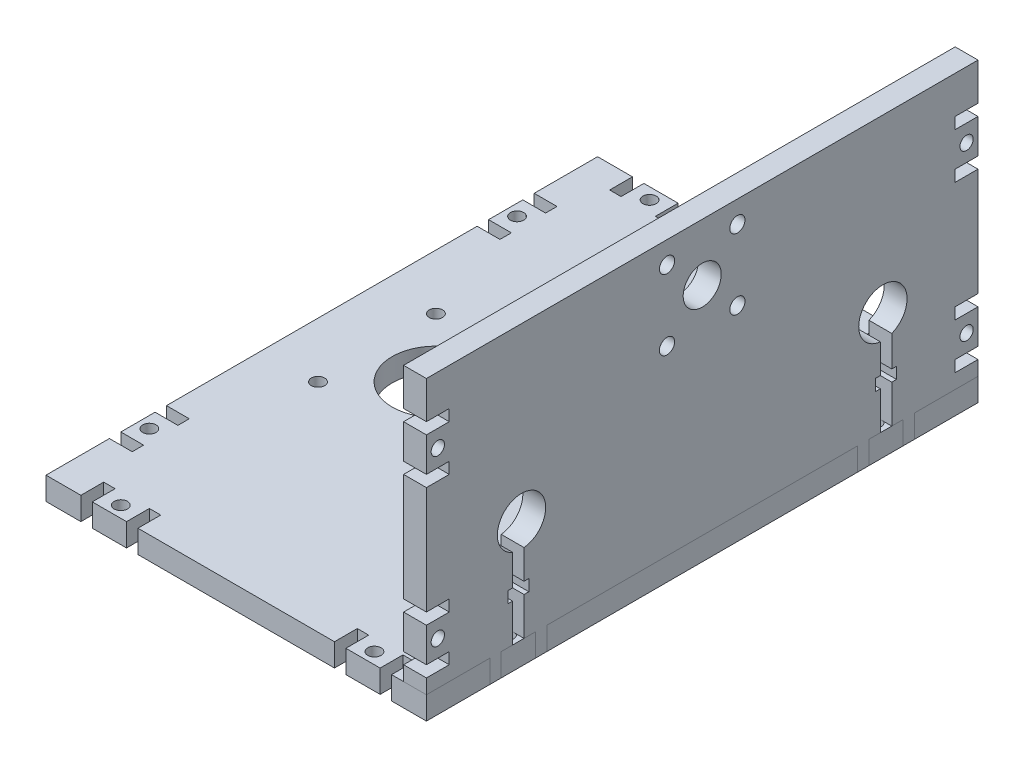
SolidWorks part; units mm, degrees
ref_plane "Front Plane" through (0, 0, 0) normal (0, 0, 1) x (1, 0, 0)
ref_plane "Top Plane" through (0, 0, 0) normal (0, 1, 0) x (1, 0, 0)
ref_plane "Right Plane" through (0, 0, 0) normal (1, 0, 0) x (0, 0, -1)
sketch "Sketch1" plane through (0, 0, 0) normal (0, 1, 0) x (1, 0, 0)
  line L1 (-50, -72.5) -> (50, -72.5)
  line L2 (-50, -72.5) -> (-50, 72.5)
  line L3 (-50, 72.5) -> (50, 72.5)
  line L4 (50, -72.5) -> (50, 72.5)
  line L5 (-50, -72.5) -> (50, 72.5) construction
  line L6 (-50, 72.5) -> (50, -72.5) construction
  point P0 (0, 0)
  dimension "D1" = 100
  dimension "D2" = 145
extrude "Boss-Extrude1" add sketch "Sketch1" along normal blind 6
sketch "Sketch2" plane through (0, 6, 0) normal (0, 1, 0) x (1, 0, 0)
  line L0 (50, 69.5) -> (-50, 69.5) construction
  line L1 (-50, -69.5) -> (50, -69.5) construction
  line L2 (-47, 72.5) -> (-47, -72.5) construction
  line L3 (50, 66.5) -> (-50, 66.5) construction
  line L4 (47, -72.5) -> (47, 72.5) construction
  line L5 (-44, 72.5) -> (-44, -72.5) construction
  line L6 (44, -72.5) -> (44, 72.5) construction
  line L7 (-50, -66.5) -> (50, -66.5) construction
  line L12 (50, -72.5) -> (50, 72.5)
  line L13 (50, 72.5) -> (-50, 72.5)
  line L14 (-50, 72.5) -> (-50, -72.5)
  line L15 (-50, -72.5) -> (50, -72.5)
  line L16 (50, -72.5) -> (50, 72.5) construction
  line L17 (50, 72.5) -> (-50, 72.5) construction
  line L18 (-50, 72.5) -> (-50, -72.5) construction
  line L19 (-50, -72.5) -> (50, -72.5) construction
  line L21 (-50, 55.8333) -> (-44, 55.8333)
  line L22 (-50, 55.8333) -> (-50, 52.8333)
  line L23 (-50, 52.8333) -> (-44, 52.8333)
  line L24 (-44, 55.8333) -> (-44, 52.8333)
  line L25 (-33.3333, 69.5) -> (-33.3333, 66.5) construction
  line L26 (-40.8333, 66.5) -> (-37.8333, 66.5)
  line L27 (-40.8333, 66.5) -> (-40.8333, 72.5)
  line L28 (-40.8333, 72.5) -> (-37.8333, 72.5)
  line L29 (-37.8333, 66.5) -> (-37.8333, 72.5)
  line L30 (-47, 48.3333) -> (-44, 48.3333) construction
  line L31 (0, 72.5) -> (0, 0) construction
  line L32 (0, 0) -> (-50, 0) construction
  line L33 (-25.8333, 72.5) -> (-28.8333, 72.5)
  line L34 (-28.8333, 66.5) -> (-28.8333, 72.5)
  line L35 (-25.8333, 66.5) -> (-28.8333, 66.5)
  line L36 (-25.8333, 66.5) -> (-25.8333, 72.5)
  line L37 (-50, 43.8333) -> (-44, 43.8333)
  line L38 (-44, 40.8333) -> (-44, 43.8333)
  line L39 (-50, 40.8333) -> (-44, 40.8333)
  line L40 (-50, 40.8333) -> (-50, 43.8333)
  line L41 (50, 40.8333) -> (50, 43.8333)
  line L42 (50, 40.8333) -> (44, 40.8333)
  line L43 (44, 40.8333) -> (44, 43.8333)
  line L44 (50, 43.8333) -> (44, 43.8333)
  line L45 (50, 52.8333) -> (44, 52.8333)
  line L46 (44, 55.8333) -> (44, 52.8333)
  line L47 (50, 55.8333) -> (44, 55.8333)
  line L48 (50, 55.8333) -> (50, 52.8333)
  line L49 (40.8333, 72.5) -> (37.8333, 72.5)
  line L50 (37.8333, 66.5) -> (37.8333, 72.5)
  line L51 (40.8333, 66.5) -> (37.8333, 66.5)
  line L52 (40.8333, 66.5) -> (40.8333, 72.5)
  line L53 (25.8333, 66.5) -> (25.8333, 72.5)
  line L54 (25.8333, 66.5) -> (28.8333, 66.5)
  line L55 (28.8333, 66.5) -> (28.8333, 72.5)
  line L56 (25.8333, 72.5) -> (28.8333, 72.5)
  line L57 (50, -40.8333) -> (44, -40.8333)
  line L58 (44, -40.8333) -> (44, -43.8333)
  line L59 (50, -43.8333) -> (44, -43.8333)
  line L60 (50, -40.8333) -> (50, -43.8333)
  line L61 (50, -55.8333) -> (50, -52.8333)
  line L62 (50, -55.8333) -> (44, -55.8333)
  line L63 (44, -55.8333) -> (44, -52.8333)
  line L64 (50, -52.8333) -> (44, -52.8333)
  line L65 (40.8333, -66.5) -> (40.8333, -72.5)
  line L66 (40.8333, -66.5) -> (37.8333, -66.5)
  line L67 (37.8333, -66.5) -> (37.8333, -72.5)
  line L68 (40.8333, -72.5) -> (37.8333, -72.5)
  line L69 (25.8333, -66.5) -> (28.8333, -66.5)
  line L70 (28.8333, -66.5) -> (28.8333, -72.5)
  line L71 (25.8333, -72.5) -> (28.8333, -72.5)
  line L72 (25.8333, -66.5) -> (25.8333, -72.5)
  line L73 (-50, -40.8333) -> (-50, -43.8333)
  line L74 (-50, -40.8333) -> (-44, -40.8333)
  line L75 (-44, -40.8333) -> (-44, -43.8333)
  line L76 (-50, -43.8333) -> (-44, -43.8333)
  line L77 (-50, -52.8333) -> (-44, -52.8333)
  line L78 (-44, -55.8333) -> (-44, -52.8333)
  line L79 (-50, -55.8333) -> (-44, -55.8333)
  line L80 (-50, -55.8333) -> (-50, -52.8333)
  line L81 (-40.8333, -72.5) -> (-37.8333, -72.5)
  line L82 (-37.8333, -66.5) -> (-37.8333, -72.5)
  line L83 (-40.8333, -66.5) -> (-37.8333, -66.5)
  line L84 (-40.8333, -66.5) -> (-40.8333, -72.5)
  line L85 (-25.8333, -66.5) -> (-25.8333, -72.5)
  line L86 (-25.8333, -66.5) -> (-28.8333, -66.5)
  line L87 (-28.8333, -66.5) -> (-28.8333, -72.5)
  line L88 (-25.8333, -72.5) -> (-28.8333, -72.5)
  circle A0 centre (-33.3333, 69.5) radius 1.75
  circle A1 centre (-47, 48.3333) radius 1.75
  circle A2 centre (47, 48.3333) radius 1.75
  circle A3 centre (33.3333, 69.5) radius 1.75
  circle A4 centre (47, -48.3333) radius 1.75
  circle A5 centre (33.3333, -69.5) radius 1.75
  circle A6 centre (-47, -48.3333) radius 1.75
  circle A7 centre (-33.3333, -69.5) radius 1.75
  point P38 (-39.3333, 66.5)
  point P39 (-44, 54.3333)
extrude "Cut-Extrude1" cut sketch "Sketch2" against normal through all
sketch "Sketch3" plane through (0, 6, 0) normal (0, 1, 0) x (1, 0, 0)
  line L0 (0, 0) -> (-20, 0) construction
  line L2 (-35.5, -15.5) -> (-4.5, -15.5) construction
  line L3 (-35.5, -15.5) -> (-35.5, 15.5) construction
  line L4 (-35.5, 15.5) -> (-4.5, 15.5) construction
  line L5 (-4.5, -15.5) -> (-4.5, 15.5) construction
  line L6 (-35.5, -15.5) -> (-4.5, 15.5) construction
  line L7 (-35.5, 15.5) -> (-4.5, -15.5) construction
  circle A0 centre (-20, 0) radius 11.5
  circle A1 centre (-4.5, 15.5) radius 1.75
  circle A2 centre (-35.5, 15.5) radius 1.75
  circle A3 centre (-35.5, -15.5) radius 1.75
  circle A4 centre (-4.5, -15.5) radius 1.75
  dimension "D1" = 31
  dimension "D2" = 23
  dimension "D4" = 3.5
  dimension "D3" = 20
extrude "Cut-Extrude2" cut sketch "Sketch3" against normal through all
sketch "Sketch4" plane through (44, 0, 0) normal (1, 0, 0) x (0, 0, -1)
  line L0 (-72.5, 6) -> (-55.8333, 6)
  line L1 (-55.8333, 6) -> (-55.8333, 0)
  line L2 (-55.8333, 0) -> (-52.8333, 0)
  line L3 (-52.8333, 0) -> (-52.8333, 6)
  line L4 (-52.8333, 6) -> (-43.8333, 6)
  line L5 (-43.8333, 6) -> (-43.8333, 0)
  line L6 (-43.8333, 0) -> (-40.8333, 0)
  line L7 (-40.8333, 0) -> (-40.8333, 6)
  line L8 (-40.8333, 6) -> (40.8333, 6)
  line L9 (40.8333, 6) -> (40.8333, 0)
  line L10 (40.8333, 0) -> (43.8333, 0)
  line L11 (43.8333, 0) -> (43.8333, 6)
  line L12 (43.8333, 6) -> (52.8333, 6)
  line L13 (52.8333, 6) -> (52.8333, 0)
  line L14 (52.8333, 0) -> (55.8333, 0)
  line L15 (55.8333, 0) -> (55.8333, 6)
  line L16 (55.8333, 6) -> (72.5, 6)
  line L17 (72.5, 6) -> (72.5, 78)
  line L18 (72.5, 78) -> (-72.5, 78)
  line L19 (-72.5, 78) -> (-72.5, 6)
  line L20 (-40.8333, 0) -> (40.8333, 0) construction
  dimension "D1" = 78
extrude "Boss-Extrude2" add sketch "Sketch4" along normal blind 6 separate body
sketch "Sketch5" plane through (50, 0, 0) normal (1, 0, 0) x (0, 0, -1)
  line L0 (-66.5, 78) -> (-66.5, 0) construction
  line L1 (72.5, 78) -> (-72.5, 78) construction
  line L2 (-66.5, 0) -> (0, 0) construction
  line L3 (-72.5, 78) -> (-72.5, 6) construction
  line L4 (-69.5, 78) -> (-69.5, 0) construction
  line L5 (-69.5, 60.6667) -> (-66.5, 60.6667) construction
  line L6 (-72.5, 68.1667) -> (-66.5, 68.1667)
  line L7 (-72.5, 68.1667) -> (-72.5, 65.1667)
  line L8 (-72.5, 65.1667) -> (-66.5, 65.1667)
  line L9 (-66.5, 68.1667) -> (-66.5, 65.1667)
  line L10 (-72.5, 56.1667) -> (-66.5, 56.1667)
  line L11 (-66.5, 53.1667) -> (-66.5, 56.1667)
  line L12 (-72.5, 53.1667) -> (-66.5, 53.1667)
  line L13 (-72.5, 53.1667) -> (-72.5, 56.1667)
  line L14 (-66.5, 39) -> (72.5, 39) construction
  line L15 (0, 0) -> (0, 78) construction
  line L16 (72.5, 6) -> (72.5, 78) construction
  line L17 (-72.5, 24.8333) -> (-72.5, 21.8333)
  line L18 (-72.5, 24.8333) -> (-66.5, 24.8333)
  line L19 (-66.5, 24.8333) -> (-66.5, 21.8333)
  line L20 (-72.5, 21.8333) -> (-66.5, 21.8333)
  line L21 (-72.5, 12.8333) -> (-66.5, 12.8333)
  line L22 (-66.5, 9.8333) -> (-66.5, 12.8333)
  line L23 (-72.5, 9.8333) -> (-66.5, 9.8333)
  line L24 (-72.5, 9.8333) -> (-72.5, 12.8333)
  line L25 (72.5, 9.8333) -> (72.5, 12.8333)
  line L26 (72.5, 9.8333) -> (66.5, 9.8333)
  line L27 (66.5, 9.8333) -> (66.5, 12.8333)
  line L28 (72.5, 12.8333) -> (66.5, 12.8333)
  line L29 (72.5, 21.8333) -> (66.5, 21.8333)
  line L30 (66.5, 24.8333) -> (66.5, 21.8333)
  line L31 (72.5, 24.8333) -> (66.5, 24.8333)
  line L32 (72.5, 24.8333) -> (72.5, 21.8333)
  line L33 (72.5, 53.1667) -> (72.5, 56.1667)
  line L34 (72.5, 53.1667) -> (66.5, 53.1667)
  line L35 (66.5, 53.1667) -> (66.5, 56.1667)
  line L36 (72.5, 56.1667) -> (66.5, 56.1667)
  line L37 (66.5, 68.1667) -> (66.5, 65.1667)
  line L38 (72.5, 65.1667) -> (66.5, 65.1667)
  line L39 (72.5, 68.1667) -> (72.5, 65.1667)
  line L40 (72.5, 68.1667) -> (66.5, 68.1667)
  circle A0 centre (-69.5, 60.6667) radius 1.75
  circle A1 centre (-69.5, 17.3333) radius 1.75
  circle A2 centre (69.5, 17.3333) radius 1.75
  circle A3 centre (69.5, 60.6667) radius 1.75
  point P17 (-66.5, 66.6667)
extrude "Cut-Extrude3" cut sketch "Sketch5" against normal through all
sketch "Sketch6" plane through (50, 0, 0) normal (1, 0, 0) x (0, 0, -1)
  line L0 (0, 78) -> (0, 63) construction
  line L1 (72.5, 78) -> (-72.5, 78) construction
  line L2 (0, 63) -> (0, 33) construction
  line L3 (47.5, 33) -> (-47.5, 33) construction
  line L5 (-9.25, 53.75) -> (9.25, 53.75) construction
  line L6 (-9.25, 53.75) -> (-9.25, 72.25) construction
  line L7 (-9.25, 72.25) -> (9.25, 72.25) construction
  line L8 (9.25, 53.75) -> (9.25, 72.25) construction
  line L9 (-9.25, 53.75) -> (9.25, 72.25) construction
  line L10 (-9.25, 72.25) -> (9.25, 53.75) construction
  circle A0 centre (0, 63) radius 5
  circle A1 centre (-47.5, 33) radius 6.35
  circle A2 centre (47.5, 33) radius 6.35
  circle A3 centre (-9.25, 72.25) radius 2
  circle A4 centre (9.25, 72.25) radius 2
  circle A5 centre (9.25, 53.75) radius 2
  circle A6 centre (-9.25, 53.75) radius 2
  point P8 (0, 33)
  dimension "D4" = 12.7
  dimension "D5" = 10
  dimension "D7" = 4
  dimension "D1" = 95
  dimension "D2" = 30
  dimension "D3" = 15
  dimension "D6" = 18.5
extrude "Cut-Extrude4" cut sketch "Sketch6" against normal through all
sketch "Sketch7" plane through (50, 0, 0) normal (1, 0, 0) x (0, 0, -1)
  line L0 (-55.8333, 0) -> (55.8333, 0) construction
  line L1 (-48.3333, 30) -> (-48.3333, 6) construction
  line L2 (-49.8333, 6) -> (-46.8333, 6)
  line L3 (-49.8333, 6) -> (-49.8333, 16)
  line L5 (-46.8333, 6) -> (-46.8333, 16)
  line L6 (-51.0892, 19) -> (-49.8333, 19)
  line L7 (-51.0892, 19) -> (-51.0892, 16)
  line L8 (-51.0892, 16) -> (-49.8333, 16)
  line L9 (-45.5774, 19) -> (-45.5774, 16)
  line L10 (-49.8333, 30) -> (-46.8333, 30)
  line L11 (-49.8333, 30) -> (-49.8333, 19)
  line L13 (-46.8333, 30) -> (-46.8333, 19)
  line L14 (-46.8333, 19) -> (-45.5774, 19)
  line L15 (-46.8333, 16) -> (-45.5774, 16)
  line L16 (-52.8333, 6) -> (-43.8333, 6) construction
  line L17 (0, 0) -> (0, 31.3408) construction
  line L18 (46.8333, 30) -> (46.8333, 19)
  line L19 (49.8333, 30) -> (46.8333, 30)
  line L20 (49.8333, 30) -> (49.8333, 19)
  line L21 (51.0892, 19) -> (49.8333, 19)
  line L22 (51.0892, 19) -> (51.0892, 16)
  line L23 (51.0892, 16) -> (49.8333, 16)
  line L24 (49.8333, 6) -> (49.8333, 16)
  line L25 (49.8333, 6) -> (46.8333, 6)
  line L26 (46.8333, 6) -> (46.8333, 16)
  line L27 (46.8333, 16) -> (45.5774, 16)
  line L28 (45.5774, 19) -> (45.5774, 16)
  line L29 (46.8333, 19) -> (45.5774, 19)
  dimension "D1" = 3
  dimension "D2" = 3
  dimension "D3" = 3
  dimension "D4" = 5.5118
  dimension "D5" = 10
  dimension "D6" = 30
extrude "Cut-Extrude5" cut sketch "Sketch7" against normal through all
equation "\"D14@Sketch2\"=(\"D12@Sketch2\"/3)/2"
equation "\"D16@Sketch2\"=\"D15@Sketch2\""
equation "\"D17@Sketch2\"=(\"D13@Sketch2\"/3)/2"
equation "\"D6@Sketch5\"=(\"D7@Sketch5\"/3)/1.5"
